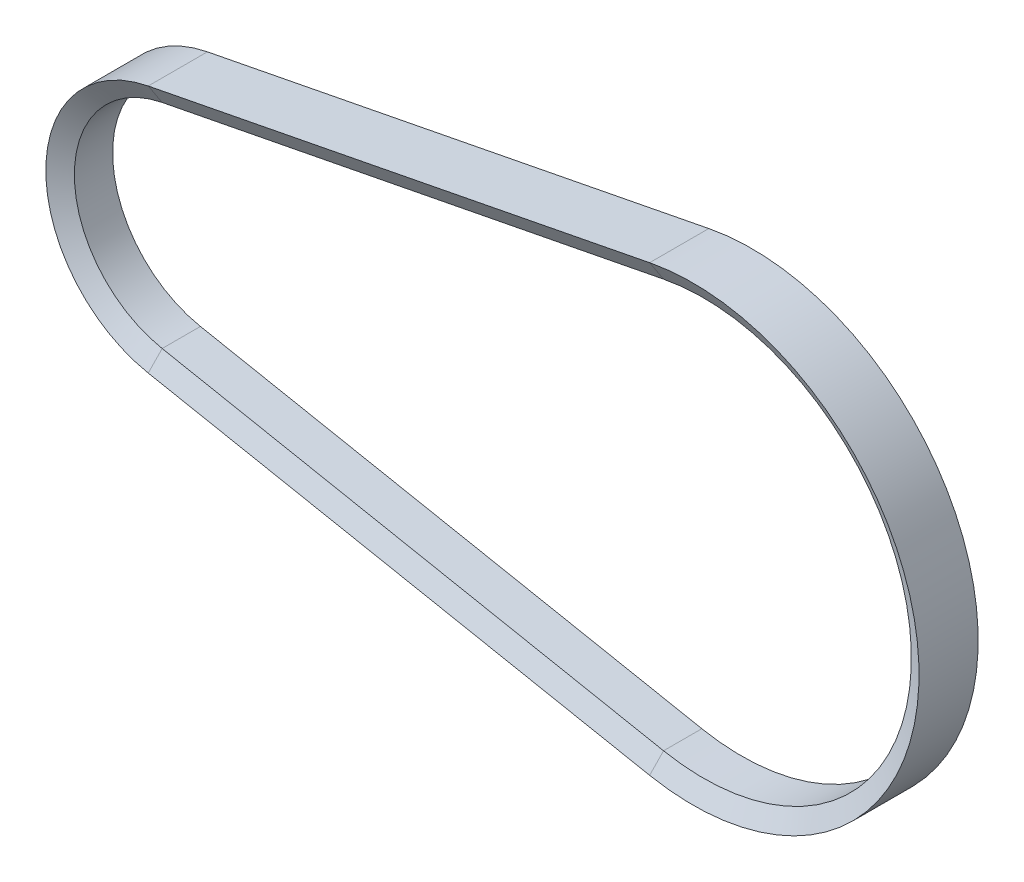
SolidWorks part; units mm, degrees
ref_plane "Face" through (0, 0, 0) normal (0, 0, 1) x (1, 0, 0)
ref_plane "Dessus" through (0, 0, 0) normal (0, 1, 0) x (1, 0, 0)
ref_plane "Droite" through (0, 0, 0) normal (1, 0, 0) x (0, 0, -1)
sketch "Esquisse1" plane through (0, 0, 0) normal (0, 0, 1) x (1, 0, 0)
  line L0 (26.5661, 11.2878) -> (-1.1472, 5.8893)
  line L1 (28.765, 0) -> (0, 0) construction
  line L2 (26.5661, -11.2878) -> (-1.1472, -5.8893)
  arc A0 (-1.1472, 5.8893) -> (-1.1472, -5.8893) centre (0, 0) ccw
  arc A1 (26.5661, -11.2878) -> (26.5661, 11.2878) centre (28.765, 0) ccw
  dimension "D2" = 6
  dimension "D3" = 11.5
  dimension "D1" = 28.765
sketch "Esquisse2" plane through (0, 0, 0) normal (0, 1, 0) x (1, 0, 0)
  line L0 (0, 0) -> (-35.5281, 0) construction
  line L1 (-7, -1.635) -> (-7, 1.635)
  line L2 (-7, 1.635) -> (-6, 1.0576)
  line L3 (-7, -1.635) -> (-6, -1.0576)
  line L4 (-6, 1.0576) -> (-6, -1.0576)
  point P6 (-7, 0)
  point P9 (-6, 0)
  dimension "D1" = 30
  dimension "D2" = 3.27
  dimension "D3" = 1
  dimension "D4" = 6
sweep "Balayage1" add profiles "Esquisse2" path "Esquisse1"
